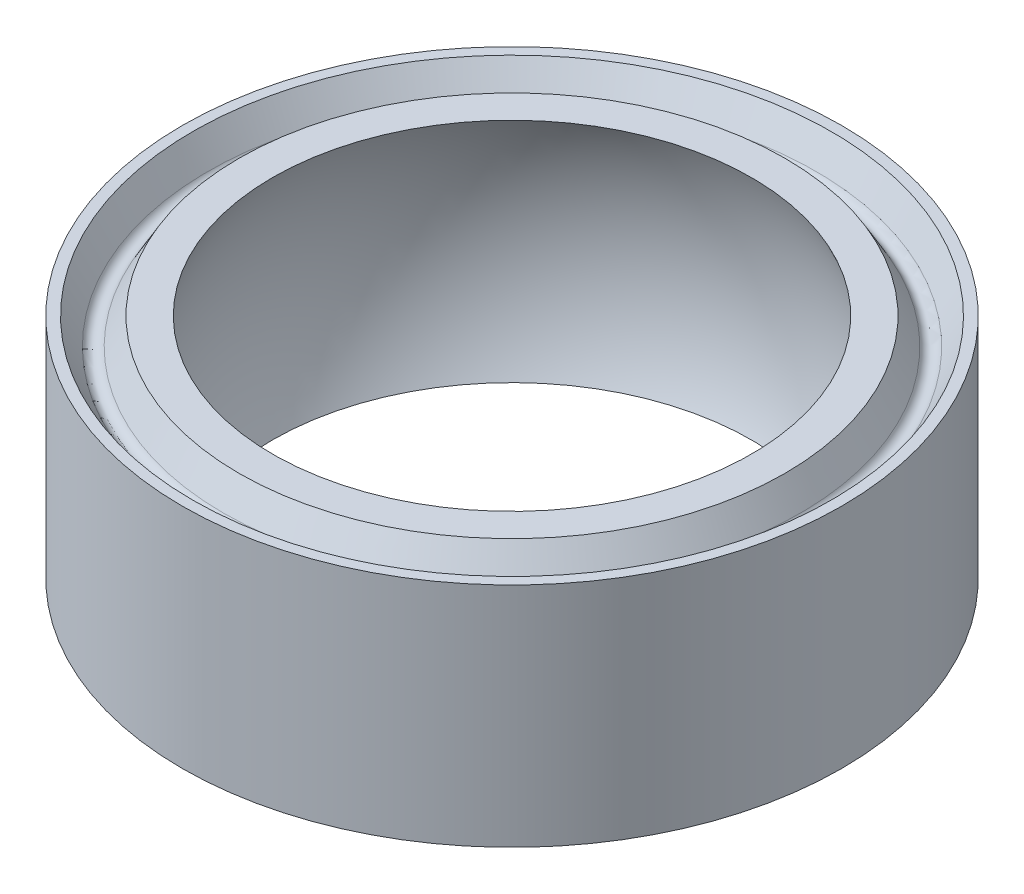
SolidWorks part; units mm, degrees
ref_plane "Front" through (0, 0, 0) normal (0, 0, 1) x (1, 0, 0)
ref_plane "Top" through (0, 0, 0) normal (0, 1, 0) x (1, 0, 0)
ref_plane "Right" through (0, 0, 0) normal (1, 0, 0) x (0, 0, -1)
sketch "Sketch1" plane through (0, 0, 0) normal (0, 0, 1) x (1, 0, 0)
  line L0 (0, 32.8906) -> (0, -34.5896) construction
  line L1 (-9.398, 3.2385) -> (-6.8274, 3.2385)
  line L2 (-9.398, 3.2385) -> (-9.398, -3.2385)
  line L3 (-9.398, -3.2385) -> (-6.8274, -3.2385)
  arc A1 (-6.8274, 3.2385) -> (-6.8274, -3.2385) centre (0, 0) ccw
  dimension "D3" = 7.5565
  dimension "D1" = 18.796
  dimension "D2" = 6.477
revolve "Revolve1" add sketch "Sketch1" angle 360 about L0
sketch "Sketch2" plane through (0, 0, 0) normal (0, 0, 1) x (1, 0, 0)
  line L0 (-7.7805, 3.2385) -> (-9.1003, 3.2385)
  line L1 (-7.7805, 3.2385) -> (-8.2204, 2.4765)
  line L2 (-8.4404, 3.2385) -> (-8.4404, 2.3495) construction
  line L3 (9.398, 3.2385) -> (-9.398, 3.2385) construction
  line L4 (0, 11.3989) -> (0, -9.3152) construction
  line L6 (-9.1003, 3.2385) -> (-8.6604, 2.4765)
  arc A0 (-8.6604, 2.4765) -> (-8.2204, 2.4765) centre (-8.4404, 2.6035) ccw
  point P14 (-8.4404, 2.3495)
  dimension "D2" = 0.254
  dimension "D4" = 30
  dimension "D1" = 0.2977
  dimension "D3" = 1.3198
revolve "Staking Groove" cut sketch "Sketch2" angle 360 about L4
mirror "Mirror Staking Groove" about plane through (0, 0, 0) normal (0, 1, 0) of "Staking Groove"
ref_point "Point1"
